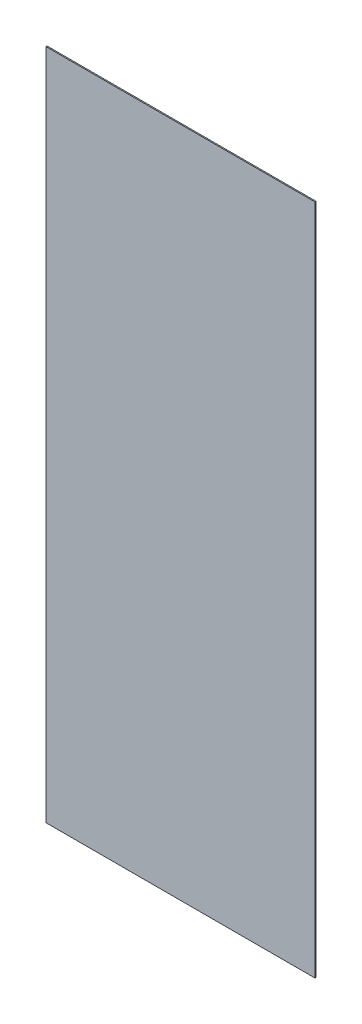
SolidWorks part; units mm, degrees
ref_plane "Front Plane" through (0, 0, 0) normal (0, 0, 1) x (1, 0, 0)
ref_plane "Top Plane" through (0, 0, 0) normal (0, 1, 0) x (1, 0, 0)
ref_plane "Right Plane" through (0, 0, 0) normal (1, 0, 0) x (0, 0, -1)
sketch "Sketch1" plane through (0, 0, 0) normal (0, 0, 1) x (1, 0, 0)
  line L1 (-609.6, 1524) -> (0, 1524)
  line L2 (-609.6, 1524) -> (-609.6, 0)
  line L3 (-609.6, 0) -> (0, 0)
  line L4 (0, 1524) -> (0, 0)
extrude "Extrude1" add sketch "Sketch1" along normal blind 2.54
